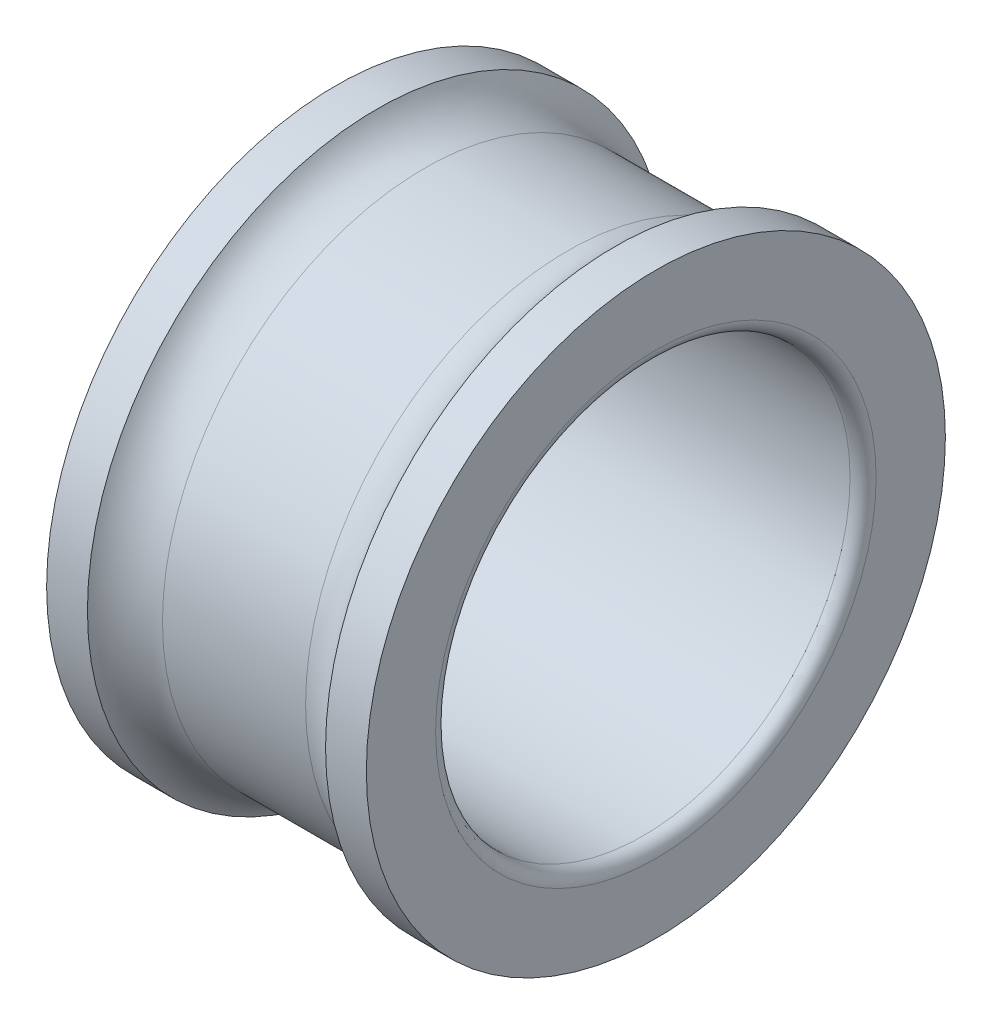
SolidWorks part; units mm, degrees
ref_plane "Plan de face" through (0, 0, 0) normal (0, 0, 1) x (1, 0, 0)
ref_plane "Plan de dessus" through (0, 0, 0) normal (0, 1, 0) x (1, 0, 0)
ref_plane "Plan de droite" through (0, 0, 0) normal (1, 0, 0) x (0, 0, -1)
sketch "Esquisse1" plane through (0, 0, 0) normal (0, 0, 1) x (1, 0, 0)
  line L0 (0, 36) -> (0, 17.5) construction
  line L1 (-12.4, 36) -> (12.4, 36) construction
  line L2 (-13.5, 34.9) -> (-13.5, 18.6) construction
  line L3 (-12.4, 17.5) -> (12.4, 17.5)
  line L4 (13.5, 34.9) -> (13.5, 18.6) construction
  line L5 (13.5, 29.05) -> (-13.5, 29.05) construction
  line L6 (13.5, 24.45) -> (10.0542, 24.45)
  line L7 (-13.5, 26.75) -> (13.5, 26.75) construction
  line L8 (-6.0417, 17.5) -> (-6.0417, 36) construction
  line L9 (0, 0) -> (13.5, 0) construction
  line L10 (10.0542, 24.45) -> (-10.0542, 24.45) construction
  line L11 (-10.0542, 24.45) -> (-13.5, 24.45)
  line L12 (13.5, 24.45) -> (13.5, 18.6)
  line L13 (-13.5, 24.45) -> (-13.5, 18.6)
  line L14 (6.0417, 22.125) -> (-6.0417, 22.125)
  arc A1 (-13.5, 18.6) -> (-12.4, 17.5) centre (-12.4, 18.6) ccw
  arc A2 (-12.4, 36) -> (-13.5, 34.9) centre (-12.4, 34.9) ccw construction
  arc A3 (13.5, 34.9) -> (12.4, 36) centre (12.4, 34.9) ccw construction
  arc A4 (12.4, 17.5) -> (13.5, 18.6) centre (12.4, 18.6) ccw
  arc A6 (-10.0542, 24.45) -> (-6.0417, 22.125) centre (-6.0417, 26.75) ccw
  arc A7 (10.0542, 24.45) -> (6.0417, 22.125) centre (6.0417, 26.75) cw
  dimension "D4" = 1.1
  dimension "D5" = 7.4583
  dimension "D8" = 9.25
  dimension "D1" = 17.5
  dimension "D2" = 36
  dimension "D3" = 27
  dimension "D6" = 24.45
  dimension "D7" = 29.05
revolve "Révolution1" add sketch "Esquisse1" angle 360 about L9
equation "\"D5@Esquisse1\"=(\"D3@Esquisse1\"-2*\"D8@Esquisse1\")/3+\"D8@Esquisse1\"/2"
